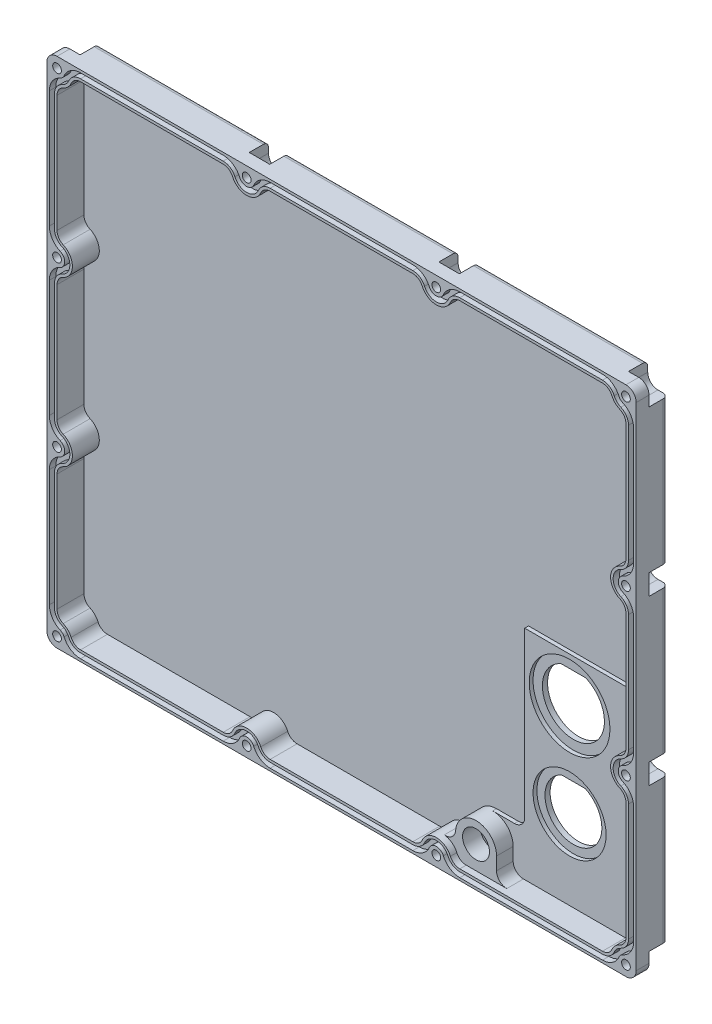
SolidWorks part; units mm, degrees
ref_plane "Спереди" through (0, 0, 0) normal (0, 0, 1) x (1, 0, 0)
ref_plane "Сверху" through (0, 0, 0) normal (0, 1, 0) x (1, 0, 0)
ref_plane "Справа" through (0, 0, 0) normal (1, 0, 0) x (0, 0, -1)
sketch "Эскиз1" plane through (0, 0, 0) normal (0, 0, 1) x (1, 0, 0)
  line L1 (-115, -100) -> (115, -100)
  line L2 (-115, -100) -> (-115, 100)
  line L3 (-115, 100) -> (115, 100)
  line L4 (115, -100) -> (115, 100)
  line L5 (-115, -100) -> (115, 100) construction
  line L6 (-115, 100) -> (115, -100) construction
  point P0 (0, 0)
  dimension "D1" = 230
  dimension "D2" = 200
extrude "Бобышка-Вытянуть1" add sketch "Эскиз1" against normal blind 20
sketch "Эскиз2" plane through (0, 0, 0) normal (0, 0, 1) x (1, 0, 0)
  line L0 (115, 100) -> (-115, 100) construction
  line L1 (-111, -96) -> (111, -96)
  line L2 (-111, -96) -> (-111, 96)
  line L3 (-111, 96) -> (111, 96)
  line L4 (111, -96) -> (111, 96)
  line L5 (-111, -96) -> (111, 96) construction
  line L6 (-111, 96) -> (111, -96) construction
  line L7 (115, -100) -> (115, 100) construction
  point P0 (0, 0)
  dimension "D1" = 4
  dimension "D2" = 4
extrude "Вырез-Вытянуть1" cut sketch "Эскиз2" against normal blind 18
sketch "Эскиз3" plane through (0, 0, 0) normal (0, 0, 1) x (1, 0, 0)
  line L1 (-115, 100) -> (115, 100)
  line L2 (-115, 100) -> (-115, -100)
  line L3 (-115, -100) -> (115, -100)
  line L4 (115, 100) -> (115, -100)
  line L5 (-115, 100) -> (115, -100) construction
  line L6 (-115, -100) -> (115, 100) construction
  point P4 (0, 0)
extrude "Вырез-Вытянуть2" cut sketch "Эскиз3" against normal blind 7.5
sketch "Эскиз4" plane through (0, 0, -20) normal (0, 0, -1) x (-1, 0, 0)
  line L1 (-115, -100) -> (-41, -100) construction
  line L2 (-115, -100) -> (-115, -16) construction
  line L3 (-115, -16) -> (-41, -16) construction
  line L4 (-41, -100) -> (-41, -16) construction
  line L5 (-115, -100) -> (-41, -16) construction
  line L6 (-115, -16) -> (-41, -100) construction
  point P4 (-78, -58)
  dimension "D1" = 84
  dimension "D2" = 74
sketch "Эскиз7" plane through (0, 0, -18) normal (0, 0, 1) x (1, 0, 0)
  line L0 (107, -11) -> (62.5, -11)
  line L1 (111, -96) -> (111, 96) construction
  line L2 (62.5, -11) -> (62.5, -75)
  line L4 (43, -96) -> (111, -96)
  line L5 (111, -96) -> (111, -7)
  line L6 (58.5, -79) -> (50, -79)
  line L11 (-115, -100) -> (115, -100) construction
  circle A0 centre (50, -87) radius 5.1 construction
  arc A1 (50, -79) -> (42.0249, -86.3693) centre (50, -87) ccw
  circle A2 centre (37, -96) radius 1.7 construction
  arc A3 (43, -96) -> (37.6224, -90.0324) centre (37, -96) ccw
  arc A4 (42.0249, -86.3693) -> (37.6224, -90.0324) centre (38.0374, -86.054) cw
  arc A5 (107, -11) -> (111, -7) centre (107, -7) ccw
  arc A6 (58.5, -79) -> (62.5, -75) centre (58.5, -75) ccw
  dimension "D3" = 12.5
  dimension "D4" = 10.2
  dimension "D7" = 16
  dimension "D10" = 3.4
  dimension "D11" = 4
  dimension "D12" = 12
  dimension "D13" = 4
  dimension "D15" = 4
  dimension "D2" = 85
  dimension "D5" = 9
  dimension "D6" = 17
  dimension "D8" = 13
  dimension "D9" = 4
  dimension "D14" = 48.5
extrude "Бобышка-Вытянуть2" add sketch "Эскиз7" along normal blind 1.5 contours A6 L6 A1 A4 A3 A5 L0 L2 M8 M5
sketch "Эскиз5" plane through (0, 0, -20) normal (0, 0, -1) x (-1, 0, 0)
  line L0 (-80, -100) -> (-80, 43) construction
  line L1 (115, -100) -> (-115, -100) construction
  line L2 (115, 100) -> (115, -100) construction
  line L3 (-99.8064, -65) -> (-60.1936, -65) construction
  line L4 (-99.8064, -28.5) -> (-60.1936, -28.5) construction
  line L5 (-84.8166, -17.4) -> (-75.1834, -17.4)
  line L6 (-84.6043, -54.9) -> (-75.3957, -54.9)
  arc A0 (-84.6043, -54.9) -> (-75.3957, -54.9) centre (-80, -65) ccw
  arc A1 (-84.8166, -17.4) -> (-75.1834, -17.4) centre (-80, -28.5) ccw
  point P11 (-80, -76.1)
  point P12 (-80, -28.5)
  point P14 (-80, -40.6)
  dimension "D4" = 21.2
  dimension "D5" = 24.2
  dimension "D6" = 11.1
  dimension "D1" = 195
  dimension "D2" = 35
  dimension "D3" = 71.5
  dimension "D7" = 23.2
extrude "Вырез-Вытянуть3" cut sketch "Эскиз5" against normal through all
sketch "Эскиз6" plane through (0, 0, -20) normal (0, 0, -1) x (-1, 0, 0)
  line L0 (115, 100) -> (115, -100) construction
  line L1 (-104, -65) -> (-80, -65) construction
  circle A0 centre (-104, -65) radius 3.9
  dimension "D1" = 7.8
  dimension "D2" = 219
extrude "Вырез-Вытянуть5" cut sketch "Эскиз6" against normal blind 2 contours A0
sketch "Эскиз9" plane through (0, 0, -16.5) normal (0, 0, 1) x (1, 0, 0)
  line L0 (58, -87) -> (58, -92)
  line L1 (62, -96) -> (43, -96)
  line L2 (111, -96) -> (-111, -96) construction
  arc A0 (58, -87) -> (42.0249, -86.3693) centre (50, -87) ccw
  arc A1 (58, -92) -> (62, -96) centre (62, -92) ccw
  arc A2 (37.6224, -90.0324) -> (42.0249, -86.3693) centre (38.0374, -86.054) ccw construction
  arc A3 (43, -96) -> (37.6224, -90.0324) centre (37, -96) ccw construction
  arc A4 (37.6224, -90.0324) -> (42.0249, -86.3693) centre (38.0374, -86.054) ccw
  arc A5 (43, -96) -> (37.6224, -90.0324) centre (37, -96) ccw
  dimension "D2" = 4
  dimension "D1" = 5
extrude "Бобышка-Вытянуть3" add sketch "Эскиз9" along normal blind 6.5
sketch "Эскиз10" plane through (0, 0, -20) normal (0, 0, -1) x (-1, 0, 0)
  line L0 (115, -100) -> (-115, -100) construction
  line L1 (-115, -100) -> (-115, 100) construction
  circle A0 centre (-50, -87) radius 5.1
  dimension "D3" = 10.2
  dimension "D1" = 13
  dimension "D2" = 65
hole_wizard "Отверстие обработанное метчиком M12x1,51" positions "Эскиз11" profile "Эскиз12" tap size "M12x1,5" standard "GOST"
sketch "Эскиз11" plane through (0, 0, -20) normal (0, 0, -1) x (-1, 0, 0)
  point P0 (-50, -87)
sketch "Эскиз12" plane through (50, -87, -20) normal (1, 0, 0) x (0, 1, 0)
  line L0 (0, 0) -> (0, 34.6545)
  line L1 (0, 34.6545) -> (5.25, 31.5)
  line L2 (5.25, 31.5) -> (5.25, 0)
  line L5 (5.25, 0) -> (0, 0)
  line L10 (0, 34.6545) -> (-5.25, 31.5) construction
  line L11 (0, -6.35) -> (0, 107.95) construction
  dimension "Диаметр сверла" = 10.5
  dimension "Глубина сверла" = 31.5
  dimension "Угол заточки сверла" = 118
chamfer "Фаска1" distance 1.85 angle 60 1 edges at (44.75, -87, -20)
sketch "Эскиз13" plane through (0, 0, -16.5) normal (0, 0, 1) x (1, 0, 0)
  circle A0 centre (80, -28.5) radius 15.75
  circle A1 centre (80, -65) radius 14.25
  dimension "D1" = 28.5
  dimension "D2" = 31.5
extrude "Вырез-Вытянуть6" cut sketch "Эскиз13" against normal blind 1.5
sketch "Эскиз14" plane through (0, 0, -20) normal (0, 0, -1) x (-1, 0, 0)
  line L0 (115, 100) -> (115, -100) construction
  line L1 (-102.7, -80.3) -> (-69.5, -80.3)
  line L2 (-104.2, -81.8) -> (-104.2, -95.5)
  line L3 (-102.7, -97) -> (-69.5, -97)
  line L4 (-68, -81.8) -> (-68, -95.5)
  line L5 (-104.2, -80.3) -> (-68, -97) construction
  line L6 (-104.2, -97) -> (-68, -80.3) construction
  line L7 (115, -100) -> (-115, -100) construction
  arc A0 (-69.5, -80.3) -> (-68, -81.8) centre (-69.5, -81.8) cw
  arc A1 (-69.5, -97) -> (-68, -95.5) centre (-69.5, -95.5) ccw
  arc A2 (-104.2, -95.5) -> (-102.7, -97) centre (-102.7, -95.5) ccw
  arc A3 (-102.7, -80.3) -> (-104.2, -81.8) centre (-102.7, -81.8) ccw
  point P4 (-86.1, -88.65)
  dimension "D5" = 1.5
  dimension "D1" = 183
  dimension "D2" = 36.2
  dimension "D3" = 3
  dimension "D4" = 16.7
extrude "Вырез-Вытянуть7" cut sketch "Эскиз14" against normal blind 1
fillet "Скругление1" radius 4 4 edges at (115, 100, -13.75) (115, -100, -13.75) (-115, -100, -13.75) (-115, 100, -13.75)
sketch "Эскиз15" plane through (0, 0, -18) normal (0, 0, 1) x (1, 0, 0)
  line L0 (-115, 96) -> (-115, -96) construction
  line L1 (115, -96) -> (115, 96) construction
  line L2 (111, 100) -> (-111, 100) construction
  line L3 (111, 96) -> (-111, 96) construction
  line L4 (-111, -100) -> (111, -100) construction
  line L5 (-46.1652, 96) -> (-27.8348, 96)
  line L6 (27.8348, 96) -> (46.1652, 96)
  line L7 (-111, 96) -> (111, 96) construction
  line L8 (101.8348, 96) -> (111, 96)
  line L9 (111, 96) -> (111, 86.8348)
  line L10 (111, -7) -> (111, 96) construction
  line L11 (-111, 96) -> (-111, 86.8348)
  line L12 (-111, 96) -> (-111, -96) construction
  line L13 (-111, 96) -> (-101.8348, 96)
  line L14 (-111, -86.8348) -> (-111, -96)
  line L15 (-111, -96) -> (-111, 96) construction
  line L16 (-111, -96) -> (-101.8348, -96)
  line L17 (111, -96) -> (-111, -96) construction
  line L18 (111, -86.8348) -> (111, -96)
  line L19 (111, 96) -> (111, -96) construction
  line L20 (111, -96) -> (101.8348, -96)
  line L21 (-46.1652, -96) -> (-27.8348, -96)
  line L22 (46.1652, -96) -> (27.8348, -96)
  line L23 (111, -96) -> (111, -7) construction
  line L24 (-111, 41.1652) -> (-111, 22.8348)
  line L25 (-111, -22.8348) -> (-111, -41.1652)
  line L26 (111, 41.1652) -> (111, 22.8348)
  line L27 (111, -22.8348) -> (111, -41.1652)
  circle A0 centre (-37, 96) radius 1.5 construction
  circle A1 centre (37, 96) radius 1.5 construction
  arc A2 (31.5009, 93.6) -> (42.4991, 93.6) centre (37, 96) ccw
  arc A3 (27.8348, 96) -> (31.5009, 93.6) centre (27.8348, 92) cw
  arc A4 (-42.4991, 93.6) -> (-31.5009, 93.6) centre (-37, 96) ccw
  arc A5 (-46.1652, 96) -> (-42.4991, 93.6) centre (-46.1652, 92) cw
  arc A6 (-27.8348, 96) -> (-31.5009, 93.6) centre (-27.8348, 92) ccw
  arc A7 (46.1652, 96) -> (42.4991, 93.6) centre (46.1652, 92) ccw
  circle A8 centre (-111, 96) radius 1.5 construction
  circle A9 centre (111, 96) radius 1.5 construction
  arc A10 (105.5009, 93.6) -> (108.6, 90.5009) centre (111, 96) ccw
  arc A11 (105.5009, 93.6) -> (101.8348, 96) centre (101.8348, 92) ccw
  arc A12 (108.6, 90.5009) -> (111, 86.8348) centre (107, 86.8348) cw
  arc A13 (-108.6, 90.5009) -> (-105.5009, 93.6) centre (-111, 96) ccw
  arc A14 (-111, 86.8348) -> (-108.6, 90.5009) centre (-107, 86.8348) cw
  arc A15 (-105.5009, 93.6) -> (-101.8348, 96) centre (-101.8348, 92) cw
  circle A16 centre (-111, -96) radius 1.5 construction
  circle A17 centre (-37, -96) radius 1.5 construction
  circle A18 centre (37, -96) radius 1.5 construction
  circle A19 centre (111, -96) radius 1.5 construction
  arc A20 (-108.6, -90.5009) -> (-105.5009, -93.6) centre (-111, -96) cw
  arc A21 (-111, -86.8348) -> (-108.6, -90.5009) centre (-107, -86.8348) ccw
  arc A22 (-105.5009, -93.6) -> (-101.8348, -96) centre (-101.8348, -92) ccw
  arc A23 (105.5009, -93.6) -> (108.6, -90.5009) centre (111, -96) cw
  arc A24 (101.8348, -96) -> (105.5009, -93.6) centre (101.8348, -92) ccw
  arc A25 (111, -86.8348) -> (108.6, -90.5009) centre (107, -86.8348) cw
  arc A26 (-42.4991, -93.6) -> (-31.5009, -93.6) centre (-37, -96) cw
  arc A27 (-46.1652, -96) -> (-42.4991, -93.6) centre (-46.1652, -92) ccw
  arc A28 (-31.5009, -93.6) -> (-27.8348, -96) centre (-27.8348, -92) ccw
  arc A29 (31.5009, -93.6) -> (42.4991, -93.6) centre (37, -96) cw
  arc A30 (31.5009, -93.6) -> (27.8348, -96) centre (27.8348, -92) cw
  arc A31 (42.4991, -93.6) -> (46.1652, -96) centre (46.1652, -92) ccw
  circle A32 centre (-111, 32) radius 1.5 construction
  circle A33 centre (-111, -32) radius 1.5 construction
  circle A34 centre (111, 32) radius 1.5 construction
  circle A35 centre (111, -32) radius 1.5 construction
  arc A36 (-108.6, 37.4991) -> (-108.6, 26.5009) centre (-111, 32) cw
  arc A37 (-111, 41.1652) -> (-108.6, 37.4991) centre (-107, 41.1652) ccw
  arc A38 (-111, 22.8348) -> (-108.6, 26.5009) centre (-107, 22.8348) cw
  arc A39 (-108.6, -26.5009) -> (-108.6, -37.4991) centre (-111, -32) cw
  arc A40 (-111, -22.8348) -> (-108.6, -26.5009) centre (-107, -22.8348) ccw
  arc A41 (-111, -41.1652) -> (-108.6, -37.4991) centre (-107, -41.1652) cw
  arc A42 (108.6, 37.4991) -> (108.6, 26.5009) centre (111, 32) ccw
  arc A43 (111, 22.8348) -> (108.6, 26.5009) centre (107, 22.8348) ccw
  arc A44 (111, 41.1652) -> (108.6, 37.4991) centre (107, 41.1652) cw
  arc A45 (108.6, -26.5009) -> (108.6, -37.4991) centre (111, -32) ccw
  arc A46 (108.6, -26.5009) -> (111, -22.8348) centre (107, -22.8348) ccw
  arc A47 (111, -41.1652) -> (108.6, -37.4991) centre (107, -41.1652) ccw
  dimension "D4" = 3
  dimension "D5" = 4
  dimension "D6" = 4
  dimension "D7" = 6
  dimension "D9" = 68
  dimension "D1" = 78
  dimension "D2" = 78
  dimension "D3" = 4
  dimension "D8" = 4
  dimension "D10" = 4
  dimension "D11" = 4
  dimension "D12" = 4
  dimension "D13" = 68
extrude "Бобышка-Вытянуть4" add sketch "Эскиз15" along normal up to surface (10.5 mm away)
sketch "Эскиз16" plane through (0, 0, -7.5) normal (0, 0, 1) x (1, 0, 0)
  line L0 (-46.1652, -96) -> (-101.8348, -96) construction
  line L2 (-111, -41.1652) -> (-111, -86.8348) construction
  line L3 (-111, -22.8348) -> (-111, 22.8348) construction
  line L4 (-111, 86.8348) -> (-111, 41.1652) construction
  line L5 (-46.1652, 96) -> (-101.8348, 96) construction
  line L6 (-46.1652, -96) -> (-101.8348, -96)
  line L7 (-111, -41.1652) -> (-111, -86.8348)
  line L9 (-111, -22.8348) -> (-111, 22.8348)
  line L10 (-111, 86.8348) -> (-111, 41.1652)
  line L11 (-46.1652, 96) -> (-101.8348, 96)
  line L12 (111, 22.8348) -> (111, -22.8348) construction
  line L13 (111, -86.8348) -> (111, -41.1652) construction
  line L14 (101.8348, -96) -> (46.1652, -96) construction
  line L15 (62, -96) -> (101.8348, -96) construction
  line L16 (27.8348, -96) -> (-27.8348, -96) construction
  line L17 (111, 22.8348) -> (111, -22.8348)
  line L18 (111, -86.8348) -> (111, -41.1652)
  line L19 (101.8348, -96) -> (46.1652, -96)
  line L20 (62, -96) -> (101.8348, -96)
  line L21 (27.8348, -96) -> (-27.8348, -96)
  line L22 (46.1652, 96) -> (101.8348, 96) construction
  line L23 (111, 86.8348) -> (111, 41.1652) construction
  line L24 (46.1652, 96) -> (101.8348, 96)
  line L25 (111, 86.8348) -> (111, 41.1652)
  line L26 (27.8348, 96) -> (-27.8348, 96) construction
  line L27 (27.8348, 96) -> (-27.8348, 96)
  line L28 (101.8348, -99) -> (46.1652, -99)
  line L29 (27.8348, -99) -> (-27.8348, -99)
  line L30 (-46.1652, -99) -> (-101.8348, -99)
  line L31 (-114, -41.1652) -> (-114, -86.8348)
  line L32 (-114, -22.8348) -> (-114, 22.8348)
  line L33 (-114, 86.8348) -> (-114, 41.1652)
  line L34 (-46.1652, 99) -> (-101.8348, 99)
  line L35 (27.8348, 99) -> (-27.8348, 99)
  line L36 (46.1652, 99) -> (101.8348, 99)
  line L37 (114, 86.8348) -> (114, 41.1652)
  line L38 (114, 22.8348) -> (114, -22.8348)
  line L39 (114, -86.8348) -> (114, -41.1652)
  line L40 (62, -99) -> (101.8348, -99)
  line L41 (-112, -22.8348) -> (-112, 22.8348)
  line L42 (-112, 86.8348) -> (-112, 41.1652)
  line L43 (-46.1652, 97) -> (-101.8348, 97)
  line L44 (27.8348, 97) -> (-27.8348, 97)
  line L45 (112, -86.8348) -> (112, -41.1652)
  line L46 (101.8348, -97) -> (46.1652, -97)
  line L47 (27.8348, -97) -> (-27.8348, -97)
  line L48 (-46.1652, -97) -> (-101.8348, -97)
  line L49 (-112, -41.1652) -> (-112, -86.8348)
  line L50 (112, 22.8348) -> (112, -22.8348)
  line L51 (112, 86.8348) -> (112, 41.1652)
  line L52 (46.1652, 97) -> (101.8348, 97)
  arc A3 (-105.5009, -93.6) -> (-101.8348, -96) centre (-101.8348, -92) ccw construction
  arc A4 (-105.5009, -93.6) -> (-108.6, -90.5009) centre (-111, -96) ccw construction
  arc A5 (-111, -86.8348) -> (-108.6, -90.5009) centre (-107, -86.8348) ccw construction
  arc A6 (-108.6, -37.4991) -> (-111, -41.1652) centre (-107, -41.1652) ccw construction
  arc A7 (-108.6, -37.4991) -> (-108.6, -26.5009) centre (-111, -32) ccw construction
  arc A8 (-111, -22.8348) -> (-108.6, -26.5009) centre (-107, -22.8348) ccw construction
  arc A9 (-108.6, 26.5009) -> (-111, 22.8348) centre (-107, 22.8348) ccw construction
  arc A10 (-108.6, 26.5009) -> (-108.6, 37.4991) centre (-111, 32) ccw construction
  arc A11 (-111, 41.1652) -> (-108.6, 37.4991) centre (-107, 41.1652) ccw construction
  arc A12 (-108.6, 90.5009) -> (-111, 86.8348) centre (-107, 86.8348) ccw construction
  arc A13 (-108.6, 90.5009) -> (-105.5009, 93.6) centre (-111, 96) ccw construction
  arc A14 (-101.8348, 96) -> (-105.5009, 93.6) centre (-101.8348, 92) ccw construction
  arc A15 (-105.5009, -93.6) -> (-101.8348, -96) centre (-101.8348, -92) ccw
  arc A16 (-105.5009, -93.6) -> (-108.6, -90.5009) centre (-111, -96) ccw
  arc A17 (-111, -86.8348) -> (-108.6, -90.5009) centre (-107, -86.8348) ccw
  arc A18 (-108.6, -37.4991) -> (-111, -41.1652) centre (-107, -41.1652) ccw
  arc A19 (-108.6, -37.4991) -> (-108.6, -26.5009) centre (-111, -32) ccw
  arc A20 (-111, -22.8348) -> (-108.6, -26.5009) centre (-107, -22.8348) ccw
  arc A21 (-108.6, 26.5009) -> (-111, 22.8348) centre (-107, 22.8348) ccw
  arc A22 (-108.6, 26.5009) -> (-108.6, 37.4991) centre (-111, 32) ccw
  arc A23 (-111, 41.1652) -> (-108.6, 37.4991) centre (-107, 41.1652) ccw
  arc A24 (-108.6, 90.5009) -> (-111, 86.8348) centre (-107, 86.8348) ccw
  arc A25 (-108.6, 90.5009) -> (-105.5009, 93.6) centre (-111, 96) ccw
  arc A26 (-101.8348, 96) -> (-105.5009, 93.6) centre (-101.8348, 92) ccw
  arc A27 (108.6, -26.5009) -> (111, -22.8348) centre (107, -22.8348) ccw construction
  arc A28 (108.6, -26.5009) -> (108.6, -37.4991) centre (111, -32) ccw construction
  arc A29 (111, -41.1652) -> (108.6, -37.4991) centre (107, -41.1652) ccw construction
  arc A30 (108.6, -90.5009) -> (111, -86.8348) centre (107, -86.8348) ccw construction
  arc A31 (108.6, -90.5009) -> (105.5009, -93.6) centre (111, -96) ccw construction
  arc A32 (101.8348, -96) -> (105.5009, -93.6) centre (101.8348, -92) ccw construction
  arc A33 (42.4991, -93.6) -> (46.1652, -96) centre (46.1652, -92) ccw construction
  arc A34 (42.4991, -93.6) -> (31.5009, -93.6) centre (37, -96) ccw construction
  arc A35 (27.8348, -96) -> (31.5009, -93.6) centre (27.8348, -92) ccw construction
  arc A36 (-31.5009, -93.6) -> (-27.8348, -96) centre (-27.8348, -92) ccw construction
  arc A37 (-31.5009, -93.6) -> (-42.4991, -93.6) centre (-37, -96) ccw construction
  arc A38 (-46.1652, -96) -> (-42.4991, -93.6) centre (-46.1652, -92) ccw construction
  arc A39 (108.6, -26.5009) -> (111, -22.8348) centre (107, -22.8348) ccw
  arc A40 (108.6, -26.5009) -> (108.6, -37.4991) centre (111, -32) ccw
  arc A41 (111, -41.1652) -> (108.6, -37.4991) centre (107, -41.1652) ccw
  arc A42 (108.6, -90.5009) -> (111, -86.8348) centre (107, -86.8348) ccw
  arc A43 (108.6, -90.5009) -> (105.5009, -93.6) centre (111, -96) ccw
  arc A44 (101.8348, -96) -> (105.5009, -93.6) centre (101.8348, -92) ccw
  arc A45 (42.4991, -93.6) -> (46.1652, -96) centre (46.1652, -92) ccw
  arc A46 (42.4991, -93.6) -> (31.5009, -93.6) centre (37, -96) ccw
  arc A47 (27.8348, -96) -> (31.5009, -93.6) centre (27.8348, -92) ccw
  arc A48 (-31.5009, -93.6) -> (-27.8348, -96) centre (-27.8348, -92) ccw
  arc A49 (-31.5009, -93.6) -> (-42.4991, -93.6) centre (-37, -96) ccw
  arc A50 (-46.1652, -96) -> (-42.4991, -93.6) centre (-46.1652, -92) ccw
  arc A51 (31.5009, 93.6) -> (27.8348, 96) centre (27.8348, 92) ccw construction
  arc A52 (31.5009, 93.6) -> (42.4991, 93.6) centre (37, 96) ccw construction
  arc A53 (46.1652, 96) -> (42.4991, 93.6) centre (46.1652, 92) ccw construction
  arc A54 (105.5009, 93.6) -> (101.8348, 96) centre (101.8348, 92) ccw construction
  arc A55 (105.5009, 93.6) -> (108.6, 90.5009) centre (111, 96) ccw construction
  arc A56 (111, 86.8348) -> (108.6, 90.5009) centre (107, 86.8348) ccw construction
  arc A57 (108.6, 37.4991) -> (111, 41.1652) centre (107, 41.1652) ccw construction
  arc A58 (108.6, 37.4991) -> (108.6, 26.5009) centre (111, 32) ccw construction
  arc A59 (111, 22.8348) -> (108.6, 26.5009) centre (107, 22.8348) ccw construction
  arc A60 (31.5009, 93.6) -> (27.8348, 96) centre (27.8348, 92) ccw
  arc A61 (31.5009, 93.6) -> (42.4991, 93.6) centre (37, 96) ccw
  arc A62 (46.1652, 96) -> (42.4991, 93.6) centre (46.1652, 92) ccw
  arc A63 (105.5009, 93.6) -> (101.8348, 96) centre (101.8348, 92) ccw
  arc A64 (105.5009, 93.6) -> (108.6, 90.5009) centre (111, 96) ccw
  arc A65 (111, 86.8348) -> (108.6, 90.5009) centre (107, 86.8348) ccw
  arc A66 (108.6, 37.4991) -> (111, 41.1652) centre (107, 41.1652) ccw
  arc A67 (108.6, 37.4991) -> (108.6, 26.5009) centre (111, 32) ccw
  arc A68 (111, 22.8348) -> (108.6, 26.5009) centre (107, 22.8348) ccw
  arc A69 (-42.4991, 93.6) -> (-46.1652, 96) centre (-46.1652, 92) ccw construction
  arc A70 (-42.4991, 93.6) -> (-31.5009, 93.6) centre (-37, 96) ccw construction
  arc A71 (-27.8348, 96) -> (-31.5009, 93.6) centre (-27.8348, 92) ccw construction
  arc A72 (-42.4991, 93.6) -> (-46.1652, 96) centre (-46.1652, 92) ccw
  arc A73 (-42.4991, 93.6) -> (-31.5009, 93.6) centre (-37, 96) ccw
  arc A74 (-27.8348, 96) -> (-31.5009, 93.6) centre (-27.8348, 92) ccw
  arc A75 (39.7495, -94.8) -> (46.1652, -99) centre (46.1652, -92) ccw
  arc A76 (39.7495, -94.8) -> (34.2505, -94.8) centre (37, -96) ccw
  arc A77 (27.8348, -99) -> (34.2505, -94.8) centre (27.8348, -92) ccw
  arc A78 (-34.2505, -94.8) -> (-27.8348, -99) centre (-27.8348, -92) ccw
  arc A79 (-34.2505, -94.8) -> (-39.7495, -94.8) centre (-37, -96) ccw
  arc A80 (-46.1652, -99) -> (-39.7495, -94.8) centre (-46.1652, -92) ccw
  arc A81 (-108.2505, -94.8) -> (-101.8348, -99) centre (-101.8348, -92) ccw
  arc A82 (-108.2505, -94.8) -> (-109.8, -93.2505) centre (-111, -96) ccw
  arc A83 (-114, -86.8348) -> (-109.8, -93.2505) centre (-107, -86.8348) ccw
  arc A84 (-109.8, -34.7495) -> (-114, -41.1652) centre (-107, -41.1652) ccw
  arc A85 (-109.8, -34.7495) -> (-109.8, -29.2505) centre (-111, -32) ccw
  arc A86 (-114, -22.8348) -> (-109.8, -29.2505) centre (-107, -22.8348) ccw
  arc A87 (-109.8, 29.2505) -> (-114, 22.8348) centre (-107, 22.8348) ccw
  arc A88 (-109.8, 29.2505) -> (-109.8, 34.7495) centre (-111, 32) ccw
  arc A89 (-114, 41.1652) -> (-109.8, 34.7495) centre (-107, 41.1652) ccw
  arc A90 (-109.8, 93.2505) -> (-114, 86.8348) centre (-107, 86.8348) ccw
  arc A91 (-109.8, 93.2505) -> (-108.2505, 94.8) centre (-111, 96) ccw
  arc A92 (-101.8348, 99) -> (-108.2505, 94.8) centre (-101.8348, 92) ccw
  arc A93 (-39.7495, 94.8) -> (-46.1652, 99) centre (-46.1652, 92) ccw
  arc A94 (-39.7495, 94.8) -> (-34.2505, 94.8) centre (-37, 96) ccw
  arc A95 (-27.8348, 99) -> (-34.2505, 94.8) centre (-27.8348, 92) ccw
  arc A96 (34.2505, 94.8) -> (27.8348, 99) centre (27.8348, 92) ccw
  arc A97 (34.2505, 94.8) -> (39.7495, 94.8) centre (37, 96) ccw
  arc A98 (46.1652, 99) -> (39.7495, 94.8) centre (46.1652, 92) ccw
  arc A99 (108.2505, 94.8) -> (101.8348, 99) centre (101.8348, 92) ccw
  arc A100 (108.2505, 94.8) -> (109.8, 93.2505) centre (111, 96) ccw
  arc A101 (114, 86.8348) -> (109.8, 93.2505) centre (107, 86.8348) ccw
  arc A102 (109.8, 34.7495) -> (114, 41.1652) centre (107, 41.1652) ccw
  arc A103 (109.8, 34.7495) -> (109.8, 29.2505) centre (111, 32) ccw
  arc A104 (114, 22.8348) -> (109.8, 29.2505) centre (107, 22.8348) ccw
  arc A105 (109.8, -29.2505) -> (114, -22.8348) centre (107, -22.8348) ccw
  arc A106 (109.8, -29.2505) -> (109.8, -34.7495) centre (111, -32) ccw
  arc A107 (114, -41.1652) -> (109.8, -34.7495) centre (107, -41.1652) ccw
  arc A108 (109.8, -93.2505) -> (114, -86.8348) centre (107, -86.8348) ccw
  arc A109 (109.8, -93.2505) -> (108.2505, -94.8) centre (111, -96) ccw
  arc A110 (101.8348, -99) -> (108.2505, -94.8) centre (101.8348, -92) ccw
  arc A111 (-109, 27.4174) -> (-112, 22.8348) centre (-107, 22.8348) ccw
  arc A112 (-109, 27.4174) -> (-109, 36.5826) centre (-111, 32) ccw
  arc A113 (-112, 41.1652) -> (-109, 36.5826) centre (-107, 41.1652) ccw
  arc A114 (-109, 91.4174) -> (-112, 86.8348) centre (-107, 86.8348) ccw
  arc A115 (-109, 91.4174) -> (-106.4174, 94) centre (-111, 96) ccw
  arc A116 (-101.8348, 97) -> (-106.4174, 94) centre (-101.8348, 92) ccw
  arc A117 (-41.5826, 94) -> (-46.1652, 97) centre (-46.1652, 92) ccw
  arc A118 (-41.5826, 94) -> (-32.4174, 94) centre (-37, 96) ccw
  arc A119 (-27.8348, 97) -> (-32.4174, 94) centre (-27.8348, 92) ccw
  arc A120 (109, -91.4174) -> (112, -86.8348) centre (107, -86.8348) ccw
  arc A121 (109, -91.4174) -> (106.4174, -94) centre (111, -96) ccw
  arc A122 (101.8348, -97) -> (106.4174, -94) centre (101.8348, -92) ccw
  arc A123 (41.5826, -94) -> (46.1652, -97) centre (46.1652, -92) ccw
  arc A124 (41.5826, -94) -> (32.4174, -94) centre (37, -96) ccw
  arc A125 (27.8348, -97) -> (32.4174, -94) centre (27.8348, -92) ccw
  arc A126 (-32.4174, -94) -> (-27.8348, -97) centre (-27.8348, -92) ccw
  arc A127 (-32.4174, -94) -> (-41.5826, -94) centre (-37, -96) ccw
  arc A128 (-46.1652, -97) -> (-41.5826, -94) centre (-46.1652, -92) ccw
  arc A129 (-106.4174, -94) -> (-101.8348, -97) centre (-101.8348, -92) ccw
  arc A130 (-106.4174, -94) -> (-109, -91.4174) centre (-111, -96) ccw
  arc A131 (-112, -86.8348) -> (-109, -91.4174) centre (-107, -86.8348) ccw
  arc A132 (-109, -36.5826) -> (-112, -41.1652) centre (-107, -41.1652) ccw
  arc A133 (-109, -36.5826) -> (-109, -27.4174) centre (-111, -32) ccw
  arc A134 (-112, -22.8348) -> (-109, -27.4174) centre (-107, -22.8348) ccw
  arc A135 (112, -41.1652) -> (109, -36.5826) centre (107, -41.1652) ccw
  arc A136 (109, -27.4174) -> (109, -36.5826) centre (111, -32) ccw
  arc A137 (109, -27.4174) -> (112, -22.8348) centre (107, -22.8348) ccw
  arc A138 (112, 22.8348) -> (109, 27.4174) centre (107, 22.8348) ccw
  arc A139 (109, 36.5826) -> (109, 27.4174) centre (111, 32) ccw
  arc A140 (109, 36.5826) -> (112, 41.1652) centre (107, 41.1652) ccw
  arc A141 (112, 86.8348) -> (109, 91.4174) centre (107, 86.8348) ccw
  arc A142 (106.4174, 94) -> (109, 91.4174) centre (111, 96) ccw
  arc A143 (106.4174, 94) -> (101.8348, 97) centre (101.8348, 92) ccw
  arc A144 (46.1652, 97) -> (41.5826, 94) centre (46.1652, 92) ccw
  arc A145 (32.4174, 94) -> (41.5826, 94) centre (37, 96) ccw
  arc A146 (32.4174, 94) -> (27.8348, 97) centre (27.8348, 92) ccw
  dimension "D1" = 3
  dimension "D2" = 1
  dimension "D3" = 1
  dimension "D4" = 1
  dimension "D5" = 1
extrude "Вырез-Вытянуть8" cut sketch "Эскиз16" against normal blind 2.5 contours L28 A110 A109 A108 L39 A107 A106 A105 L38 A104 A103 A102 L37 A101 A100 A99 L36 A98 A97 A96 L35 A95 A94 A93 L34 A92 A91 A90 L33 A89 A88 A87 L32 A86 A85 A84 L31 A83 A82 A81 L30 A80 A79 A78 L29 A77 A76 A75 A146
sketch "Эскиз18" plane through (0, 0, -7.5) normal (0, 0, 1) x (1, 0, 0)
  line L0 (-46.1652, 96) -> (-27.8348, 96) construction
  line L1 (-111, 41.1652) -> (-111, 22.8348) construction
  circle A0 centre (-111, 96) radius 1.7
  circle A1 centre (-37, 96) radius 1.7
  circle A2 centre (37, 96) radius 1.7
  circle A3 centre (111, 96) radius 1.7
  circle A4 centre (111, 32) radius 1.7
  circle A5 centre (111, -32) radius 1.7
  circle A6 centre (111, -96) radius 1.7
  circle A7 centre (37, -96) radius 1.7
  circle A8 centre (-37, -96) radius 1.7
  circle A9 centre (-111, -96) radius 1.7
  circle A10 centre (-111, -32) radius 1.7
  circle A11 centre (-111, 32) radius 1.7
  dimension "D1" = 3.4
extrude "Вырез-Вытянуть9" cut sketch "Эскиз18" against normal through all
sketch "Эскиз19" plane through (0, 0, -20) normal (0, 0, -1) x (-1, 0, 0)
  line L0 (41, -96) -> (41, -100)
  line L1 (111, -100) -> (-111, -100) construction
  line L2 (41, -100) -> (33, -100)
  line L3 (33, -100) -> (33, -96)
  line L4 (-33, -96) -> (-33, -100)
  line L5 (-33, -100) -> (-41, -100)
  line L6 (-41, -100) -> (-41, -96)
  line L7 (-111, -36) -> (-115, -36)
  line L8 (-115, -96) -> (-115, 96) construction
  line L9 (-115, -36) -> (-115, -28)
  line L10 (-115, -28) -> (-111, -28)
  line L11 (-111, 28) -> (-115, 28)
  line L12 (-115, 28) -> (-115, 36)
  line L13 (-115, 36) -> (-111, 36)
  line L14 (-33, 96) -> (-33, 100)
  line L15 (-111, 100) -> (111, 100) construction
  line L16 (-33, 100) -> (-41, 100)
  line L17 (-41, 100) -> (-41, 96)
  line L18 (41, 96) -> (41, 100)
  line L19 (41, 100) -> (33, 100)
  line L20 (33, 100) -> (33, 96)
  line L21 (111, 28) -> (115, 28)
  line L22 (115, 96) -> (115, -96) construction
  line L23 (115, 28) -> (115, 36)
  line L24 (115, 36) -> (111, 36)
  line L25 (111, -36) -> (115, -36)
  line L26 (115, -36) -> (115, -28)
  line L27 (115, -28) -> (111, -28)
  line L28 (115, -96) -> (115, -92)
  line L29 (111, -100) -> (107, -100)
  line L30 (115, -92) -> (111, -92)
  line L31 (107, -100) -> (107, -96)
  line L32 (-111, -100) -> (-107, -100)
  line L33 (-115, -96) -> (-115, -92)
  line L34 (-107, -96) -> (-107, -100)
  line L35 (-111, -92) -> (-115, -92)
  line L36 (-115, 96) -> (-115, 92)
  line L37 (-111, 100) -> (-107, 100)
  line L38 (-111, 92) -> (-115, 92)
  line L39 (-107, 96) -> (-107, 100)
  line L40 (115, 96) -> (115, 92)
  line L41 (111, 100) -> (107, 100)
  line L42 (111, 92) -> (115, 92)
  line L43 (107, 96) -> (107, 100)
  arc A0 (41, -96) -> (33, -96) centre (37, -96) ccw
  arc A1 (-33, -96) -> (-41, -96) centre (-37, -96) ccw
  arc A2 (-111, -36) -> (-111, -28) centre (-111, -32) ccw
  arc A3 (-111, 28) -> (-111, 36) centre (-111, 32) ccw
  arc A4 (-33, 96) -> (-41, 96) centre (-37, 96) cw
  arc A5 (33, 96) -> (41, 96) centre (37, 96) ccw
  arc A6 (111, 28) -> (111, 36) centre (111, 32) cw
  arc A7 (111, -36) -> (111, -28) centre (111, -32) cw
  arc A8 (115, -96) -> (111, -100) centre (111, -96) cw
  arc A9 (111, -100) -> (115, -96) centre (111, -96) ccw construction
  arc A10 (111, -92) -> (107, -96) centre (111, -96) ccw
  arc A11 (-111, -100) -> (-115, -96) centre (-111, -96) cw
  arc A12 (-115, -96) -> (-111, -100) centre (-111, -96) ccw construction
  arc A13 (-107, -96) -> (-111, -92) centre (-111, -96) ccw
  arc A14 (-111, 100) -> (-115, 96) centre (-111, 96) ccw
  arc A15 (-111, 100) -> (-115, 96) centre (-111, 96) ccw construction
  arc A16 (-111, 92) -> (-107, 96) centre (-111, 96) ccw
  arc A17 (111, 92) -> (107, 96) centre (111, 96) cw
  arc A18 (115, 96) -> (111, 100) centre (111, 96) ccw
  arc A19 (115, 96) -> (111, 100) centre (111, 96) ccw construction
  dimension "D1" = 4
  dimension "D2" = 4
  dimension "D3" = 4
  dimension "D4" = 4
  dimension "D5" = 4
  dimension "D6" = 4
  dimension "D7" = 4
  dimension "D8" = 4
  dimension "D9" = 4
  dimension "D10" = 4
  dimension "D11" = 4
  dimension "D12" = 4
extrude "Вырез-Вытянуть10" cut sketch "Эскиз19" against normal blind 7.5
sketch "Эскиз20" plane through (0, 0, -20) normal (0, 0, -1) x (-1, 0, 0)
  line L0 (-104, -78) -> (-104, -65) construction
  line L1 (-115, -92) -> (-115, -36) construction
  line L2 (-96, -78) -> (-112, -78) construction
  line L3 (-80, -28.5) -> (-40, -28.5) construction
  line L4 (-80, -65) -> (-40, -65) construction
  line L5 (-62, -10.4934) -> (-62, -77.8526) construction
  line L6 (-62, -63) -> (-40, -63) construction
  line L7 (-62, -72) -> (-40, -72) construction
  line L8 (-62, -35.5) -> (-40, -35.5) construction
  line L9 (-62, -26.5) -> (-40, -26.5) construction
  line L10 (-104, -47.575) -> (-104, -51.95) construction
  line L11 (-107.45, -51.95) -> (-100.55, -51.95) construction
  line L12 (-106.2, -53.175) -> (-101.8, -53.175) construction
  line L13 (-104.95, -54.425) -> (-103.05, -54.425) construction
  line L14 (-104.31, -47.575) -> (-104.31, -51.64)
  line L15 (-112.125, -59.125) -> (-95.875, -59.125) construction
  line L16 (-112.125, -59.125) -> (-112.125, -42.875) construction
  line L17 (-112.125, -42.875) -> (-95.875, -42.875) construction
  line L18 (-95.875, -59.125) -> (-95.875, -42.875) construction
  line L19 (-112.125, -59.125) -> (-95.875, -42.875) construction
  line L20 (-112.125, -42.875) -> (-95.875, -59.125) construction
  line L21 (-104.31, -51.64) -> (-107.45, -51.64)
  line L22 (-103.69, -47.575) -> (-103.69, -51.64)
  line L23 (-103.69, -51.64) -> (-100.55, -51.64)
  line L24 (-107.45, -52.26) -> (-100.55, -52.26)
  line L25 (-106.2, -52.865) -> (-101.8, -52.865)
  line L26 (-101.8, -53.485) -> (-106.2, -53.485)
  line L27 (-104.95, -54.115) -> (-103.05, -54.115)
  line L28 (-104.95, -54.735) -> (-103.05, -54.735)
  circle A0 centre (-104, -51) radius 5.1375
  circle A1 centre (-104, -51) radius 4.825 construction
  circle A2 centre (-104, -51) radius 4.5125
  arc A3 (-104.31, -47.575) -> (-103.69, -47.575) centre (-104, -47.575) cw
  arc A4 (-100.55, -51.64) -> (-100.55, -52.26) centre (-100.55, -51.95) cw
  arc A5 (-107.45, -51.64) -> (-107.45, -52.26) centre (-107.45, -51.95) ccw
  arc A6 (-106.2, -52.865) -> (-106.2, -53.485) centre (-106.2, -53.175) ccw
  arc A7 (-101.8, -52.865) -> (-101.8, -53.485) centre (-101.8, -53.175) cw
  arc A8 (-103.05, -54.115) -> (-103.05, -54.735) centre (-103.05, -54.425) cw
  arc A9 (-104.95, -54.115) -> (-104.95, -54.735) centre (-104.95, -54.425) ccw
  text T0 "XP2" font "GOST 26.008—85" height 5
  text T1 "DVI" font "GOST 26.008—85" height 5
  text T2 "XP1" font "GOST 26.008—85" height 5
  text T3 "+27V" font "GOST 26.008—85" height 5
  text T4 "X1" font "GOST 26.008—85" height 5
  point P3 (-104, -65)
  point P6 (-104, -78)
  point P13 (-104, -51)
  point P35 (-104, -51.95)
  point P40 (-104, -53.175)
  point P41 (-104, -54.425)
  dimension "D8" = 9.65
  dimension "D9" = 0.3125
  dimension "D10" = 0.3125
  dimension "D1" = 14
  dimension "D2" = 11
  dimension "D3" = 18
  dimension "D4" = 2
  dimension "D5" = 7
  dimension "D6" = 2
  dimension "D7" = 7
  dimension "D11" = 8.125
  dimension "D12" = 6.85
  dimension "D13" = 4.7
  dimension "D14" = 1.25
  dimension "D15" = 0.95
  dimension "D16" = 2.475
  dimension "D17" = 0.31
  dimension "D18" = 0.31
  dimension "D19" = 0.31
  dimension "D20" = 0.31
  dimension "D21" = 0.31
  dimension "D22" = 0.31
  dimension "D23" = 0.31
  dimension "D24" = 0.31
  dimension "D25" = 1.9
  dimension "D26" = 4.4
  dimension "D27" = 6.9
  dimension "D28" = 13
extrude "Вырез-Вытянуть11_заземление" cut sketch "Эскиз20" against normal blind 0.1 contours L21 A5 L24 A4 L23 L22 A3 L14 | A7 L25 A6 L26 | L27 A9 L28 A8 | A0 A2
sketch "Эскиз21" plane through (0, 0, -20) normal (0, 0, -1) x (-1, 0, 0)
  line L0 (-104, -65) -> (-104, -78) construction
  line L1 (-112, -78) -> (-96, -78) construction
  line L2 (-62, -10.4934) -> (-62, -77.8526) construction
  line L3 (-62, -72) -> (-40, -72) construction
  line L4 (-40, -65) -> (-80, -65) construction
  line L5 (-40, -63) -> (-62, -63) construction
  line L6 (-40, -35.5) -> (-62, -35.5) construction
  line L7 (-40, -28.5) -> (-80, -28.5) construction
  line L8 (-40, -26.5) -> (-62, -26.5) construction
  text T0 "X1" font "GOST 26.008—85" height 5
  text T1 "XP2" font "GOST 26.008—85" height 5
  text T2 "DVI" font "GOST 26.008—85" height 5
  text T3 "XP1" font "GOST 26.008—85" height 5
  text T4 "+27V" font "GOST 26.008—85" height 5
extrude "Вырез-Вытянуть11" cut sketch "Эскиз21" against normal blind 0.1
fillet "Скругление2" radius 2 12 edges at (-115, 0, -20) (-115, -64, -20) (-74, -100, -20) (0, -100, -20) (74, -100, -20) (115, -64, -20) (115, 0, -20) (115, 64, -20) (74, 100, -20) (0, 100, -20) (-74, 100, -20) (-115, 64, -20)
